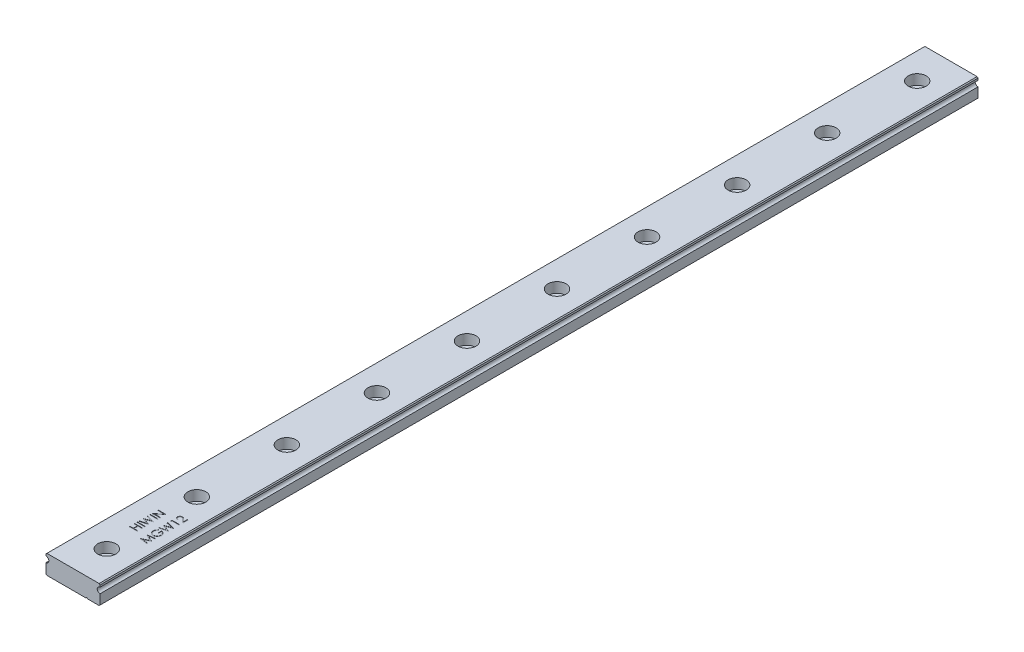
SolidWorks part; units mm, degrees
ref_plane "前视基准面" through (0, 0, 0) normal (0, 0, 1) x (1, 0, 0)
ref_plane "上视基准面" through (0, 0, 0) normal (0, 1, 0) x (1, 0, 0)
ref_plane "右视基准面" through (0, 0, 0) normal (1, 0, 0) x (0, 0, -1)
sketch "草图1" plane through (0, 0, 0) normal (0, 0, 1) x (1, 0, 0)
  line L12 (-11.6, 8.5) -> (-12, 8.1)
  line L13 (12, 8.1) -> (11.6, 8.5)
  line L14 (11.6, 0) -> (12, 0.4)
  line L15 (12, 7.25) -> (12, 8.1)
  line L16 (0, 8.5) -> (0, 0) construction
  line L17 (12, 0.4) -> (12, 4.75)
  line L18 (6.3, 0) -> (11.6, 0)
  line L19 (-12, 0.4) -> (-11.6, 0)
  line L20 (-12, 8.1) -> (-12, 7.25)
  line L21 (-11.6, 0) -> (5.7, 0)
  line L22 (11.6, 8.5) -> (-11.6, 8.5)
  line L23 (-12, 4.75) -> (-12, 0.4)
  arc A3 (-12, 4.75) -> (-12, 7.25) centre (-12, 6) ccw
  arc A4 (6.3, 0) -> (5.7, 0) centre (6, 0) ccw
  arc A5 (12, 7.25) -> (12, 4.75) centre (12, 6) ccw
extrude "凸台-拉伸1" add sketch "草图1" against normal blind 390
hole_wizard "M4 六角凹头螺钉的柱形沉头孔1" positions "草图3" profile "草图2" counterbore size "M4" standard "ISO"
sketch "草图3" plane through (-2.1754, 8.5, -52.9752) normal (0, 1, 0) x (-1, 0, 0)
  line L4 (-13.7754, 52.9752) -> (9.4246, 52.9752) construction
  point P15 (-2.1754, 37.9752)
  dimension "D1" = 15
sketch "草图2" plane through (0, 8.5, -15) normal (1, 0, 0) x (0, 0, 1)
  line L0 (0, 0) -> (0, 8.5)
  line L1 (0, 8.5) -> (2.25, 8.5)
  line L3 (2.25, 8.5) -> (2.25, 4.5)
  line L4 (2.25, 4.5) -> (4, 4.5)
  line L5 (4, 4.5) -> (4, 0)
  line L7 (4, 0) -> (0, 0)
  line L11 (0, -6.35) -> (0, 107.95) construction
  dimension "通孔孔直径" = 4.5
  dimension "通孔孔深度" = 8.5
  dimension "柱形沉头孔直径" = 8
  dimension "柱形沉头孔深度" = 4.5
pattern_linear "阵列(线性)1" count 10 spacing 40 along (0, 0, -1) of "M4 六角凹头螺钉的柱形沉头孔1"
sketch "草图4" plane through (0, 8.5, 0) normal (0, 1, 0) x (1, 0, 0)
  line L2 (0, 15) -> (0, 55) construction
  text T0 "HIWIN  MGW12"
extrude "切除-拉伸1" cut sketch "草图4" against normal blind 0.1
equation "\"D1@凸台-拉伸1\" = 2 * \"D1@草图3\" + \"D3@阵列(线性)1\" *  (\"D1@阵列(线性)1\" - 1  ) "
